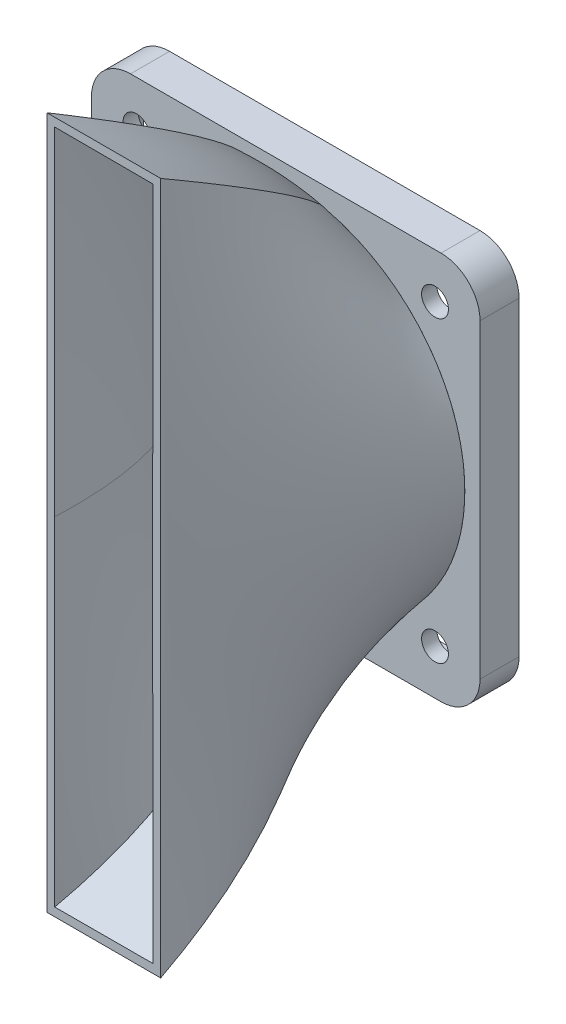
SolidWorks part; units mm, degrees
ref_plane "Front Plane" through (0, 0, 0) normal (0, 0, 1) x (1, 0, 0)
ref_plane "Top Plane" through (0, 0, 0) normal (0, 1, 0) x (1, 0, 0)
ref_plane "Right Plane" through (0, 0, 0) normal (1, 0, 0) x (0, 0, -1)
sketch "Sketch1" plane through (0, 0, 0) normal (0, 0, 1) x (1, 0, 0)
  line L8 (-1242.2558, 656.3739) -> (-1242.2558, 659.0739) construction
  line L9 (-1239.7158, 656.3739) -> (-1239.7158, 659.0739)
  line L10 (-1239.7158, 659.0739) -> (-1239.7158, 671.0739)
  line L11 (-1246.2558, 677.6139) -> (-1298.2558, 677.6139)
  line L12 (-1304.7958, 671.0739) -> (-1304.7958, 619.0739)
  line L13 (-1298.2558, 612.5339) -> (-1246.2558, 612.5339)
  line L14 (-1239.7158, 619.0739) -> (-1239.7158, 656.3739)
  line L18 (-1242.2558, 659.0739) -> (-1242.2558, 671.0739) construction
  line L19 (-1246.2558, 675.0739) -> (-1298.2558, 675.0739) construction
  line L20 (-1302.2558, 671.0739) -> (-1302.2558, 619.0739) construction
  line L21 (-1298.2558, 615.0739) -> (-1246.2558, 615.0739) construction
  line L22 (-1242.2558, 619.0739) -> (-1242.2558, 656.3739) construction
  arc A9 (-1239.7158, 671.0739) -> (-1246.2558, 677.6139) centre (-1246.2558, 671.0739) ccw
  arc A10 (-1298.2558, 677.6139) -> (-1304.7958, 671.0739) centre (-1298.2558, 671.0739) ccw
  arc A11 (-1304.7958, 619.0739) -> (-1298.2558, 612.5339) centre (-1298.2558, 619.0739) ccw
  arc A12 (-1246.2558, 612.5339) -> (-1239.7158, 619.0739) centre (-1246.2558, 619.0739) ccw
  arc A23 (-1242.2558, 671.0739) -> (-1246.2558, 675.0739) centre (-1246.2558, 671.0739) ccw construction
  arc A24 (-1298.2558, 675.0739) -> (-1302.2558, 671.0739) centre (-1298.2558, 671.0739) ccw construction
  arc A25 (-1302.2558, 619.0739) -> (-1298.2558, 615.0739) centre (-1298.2558, 619.0739) ccw construction
  arc A26 (-1246.2558, 615.0739) -> (-1242.2558, 619.0739) centre (-1246.2558, 619.0739) ccw construction
  arc A30 (-1249.5058, 620.0739) -> (-1245.0058, 620.0739) centre (-1247.2558, 620.0739) ccw
  arc A31 (-1245.0058, 620.0739) -> (-1249.5058, 620.0739) centre (-1247.2558, 620.0739) ccw
  arc A32 (-1249.5058, 670.0739) -> (-1245.0058, 670.0739) centre (-1247.2558, 670.0739) ccw
  arc A33 (-1245.0058, 670.0739) -> (-1249.5058, 670.0739) centre (-1247.2558, 670.0739) ccw
  arc A34 (-1295.0058, 670.0739) -> (-1299.5058, 670.0739) centre (-1297.2558, 670.0739) ccw
  arc A35 (-1299.5058, 670.0739) -> (-1295.0058, 670.0739) centre (-1297.2558, 670.0739) ccw
  arc A36 (-1295.0058, 620.0739) -> (-1299.5058, 620.0739) centre (-1297.2558, 620.0739) ccw
  arc A37 (-1299.5058, 620.0739) -> (-1295.0058, 620.0739) centre (-1297.2558, 620.0739) ccw
  circle A40 centre (-1272.2558, 645.0739) radius 30
  dimension "D1" = 2.54
extrude "Boss-Extrude2" add sketch "Sketch1" along normal blind 2.54
sketch "Sketch2" plane through (0, 0, 0) normal (0, 0, -1) x (-1, 0, 0)
  line L8 (1242.2558, 659.0739) -> (1242.2558, 656.3739) construction
  line L9 (1241.8558, 659.0739) -> (1241.8558, 656.3739)
  line L10 (1241.8558, 656.3739) -> (1241.8558, 619.0739)
  line L11 (1246.2558, 614.6739) -> (1298.2558, 614.6739)
  line L12 (1302.6558, 619.0739) -> (1302.6558, 671.0739)
  line L13 (1298.2558, 675.4739) -> (1246.2558, 675.4739)
  line L14 (1241.8558, 671.0739) -> (1241.8558, 659.0739)
  line L18 (1242.2558, 671.0739) -> (1242.2558, 659.0739) construction
  line L19 (1298.2558, 675.0739) -> (1246.2558, 675.0739) construction
  line L20 (1302.2558, 619.0739) -> (1302.2558, 671.0739) construction
  line L21 (1246.2558, 615.0739) -> (1298.2558, 615.0739) construction
  line L22 (1242.2558, 656.3739) -> (1242.2558, 619.0739) construction
  line L27 (1239.7158, 671.0739) -> (1239.7158, 619.0739)
  line L28 (1246.2558, 612.5339) -> (1298.2558, 612.5339)
  line L29 (1304.7958, 619.0739) -> (1304.7958, 671.0739)
  line L30 (1298.2558, 677.6139) -> (1246.2558, 677.6139)
  line L31 (1239.7158, 671.0739) -> (1239.7158, 619.0739)
  line L32 (1246.2558, 612.5339) -> (1298.2558, 612.5339)
  line L33 (1304.7958, 619.0739) -> (1304.7958, 671.0739)
  line L34 (1298.2558, 677.6139) -> (1246.2558, 677.6139)
  arc A9 (1241.8558, 619.0739) -> (1246.2558, 614.6739) centre (1246.2558, 619.0739) ccw
  arc A10 (1298.2558, 614.6739) -> (1302.6558, 619.0739) centre (1298.2558, 619.0739) ccw
  arc A11 (1302.6558, 671.0739) -> (1298.2558, 675.4739) centre (1298.2558, 671.0739) ccw
  arc A12 (1246.2558, 675.4739) -> (1241.8558, 671.0739) centre (1246.2558, 671.0739) ccw
  arc A17 (1239.7158, 619.0739) -> (1246.2558, 612.5339) centre (1246.2558, 619.0739) ccw
  arc A23 (1246.2558, 675.0739) -> (1242.2558, 671.0739) centre (1246.2558, 671.0739) ccw construction
  arc A24 (1302.2558, 671.0739) -> (1298.2558, 675.0739) centre (1298.2558, 671.0739) ccw construction
  arc A25 (1298.2558, 615.0739) -> (1302.2558, 619.0739) centre (1298.2558, 619.0739) ccw construction
  arc A26 (1242.2558, 619.0739) -> (1246.2558, 615.0739) centre (1246.2558, 619.0739) ccw construction
  arc A27 (1298.2558, 612.5339) -> (1304.7958, 619.0739) centre (1298.2558, 619.0739) ccw
  arc A28 (1304.7958, 671.0739) -> (1298.2558, 677.6139) centre (1298.2558, 671.0739) ccw
  arc A29 (1246.2558, 677.6139) -> (1239.7158, 671.0739) centre (1246.2558, 671.0739) ccw
  arc A30 (1239.7158, 619.0739) -> (1246.2558, 612.5339) centre (1246.2558, 619.0739) ccw
  arc A31 (1298.2558, 612.5339) -> (1304.7958, 619.0739) centre (1298.2558, 619.0739) ccw
  arc A32 (1304.7958, 671.0739) -> (1298.2558, 677.6139) centre (1298.2558, 671.0739) ccw
  arc A33 (1246.2558, 677.6139) -> (1239.7158, 671.0739) centre (1246.2558, 671.0739) ccw
  dimension "D1" = 0.4
  dimension "D2" = 0
extrude "Boss-Extrude3" add sketch "Sketch2" along normal up to surface (4 mm away) contours A12 L13 A11 L12 A10 L11 A9 L10 L9 L14 M45 M38 M39 M40 M41 M42 M43 M44
ref_plane "Plane1" through (0, 0, 40.64) normal (0, 0, 1) x (1, 0, 0)
sketch "Sketch3" plane through (0, 0, 2.54) normal (0, 0, 1) x (1, 0, 0)
  circle A9 centre (-1272.2558, 645.0739) radius 30
  circle A10 centre (-1272.2558, 645.0739) radius 30
  dimension "D5" = 0
sketch "Sketch4" plane through (0, 0, 40.64) normal (0, 0, 1) x (1, 0, 0)
  line L20 (-1274.1608, 587.0772) -> (-1255.1108, 587.0772)
  line L21 (-1274.1608, 587.0772) -> (-1274.1608, 703.0706)
  line L22 (-1274.1608, 703.0706) -> (-1255.1108, 703.0706)
  line L23 (-1255.1108, 587.0772) -> (-1255.1108, 703.0706)
  point P15 (-1274.1608, 587.0772)
  point P16 (-1255.1108, 703.0706)
ref_plane "Plane2" through (0, 645.0739, 0) normal (0, -1, 0) x (-1, 0, 0)
sketch "Sketch5" plane through (0, 645.0739, 0) normal (0, -1, 0) x (-1, 0, 0)
  line L1 (1288.5406, -318.743) -> (1288.5406, -8.228) construction
  line L2 (1274.1608, -40.64) -> (1255.1108, -40.64) construction
  line L3 (1242.2558, -2.54) -> (1302.2558, -2.54) construction
  line L4 (1274.1608, -40.64) -> (1255.1108, -40.64) construction
  line L5 (1242.2558, -2.54) -> (1302.2558, -2.54) construction
  line L6 (1302.2558, -2.54) -> (1274.1608, -40.64) construction
  line L7 (1288.5406, -8.228) -> (1286.0006, -8.228) construction
  spline S0 degree 2 poles (1302.2558, -2.54) (1272.6699, -5.8383) (1274.1608, -40.64) knots 0 0 0 1 1 1
  dimension "D1" = 2.54
sketch "Sketch6" plane through (0, 645.0739, 0) normal (0, -1, 0) x (-1, 0, 0)
  line L0 (1242.2558, -2.54) -> (1302.2558, -2.54) construction
  line L1 (1274.1608, -40.64) -> (1255.1108, -40.64) construction
  line L2 (1242.2558, -2.54) -> (1302.2558, -2.54) construction
  line L3 (1274.1608, -40.64) -> (1255.1108, -40.64) construction
  line L4 (1242.2558, -2.54) -> (1255.1108, -40.64)
loft "Loft-Thin1" add profiles "Sketch3", "Sketch4" parameters "D1"=1.27
